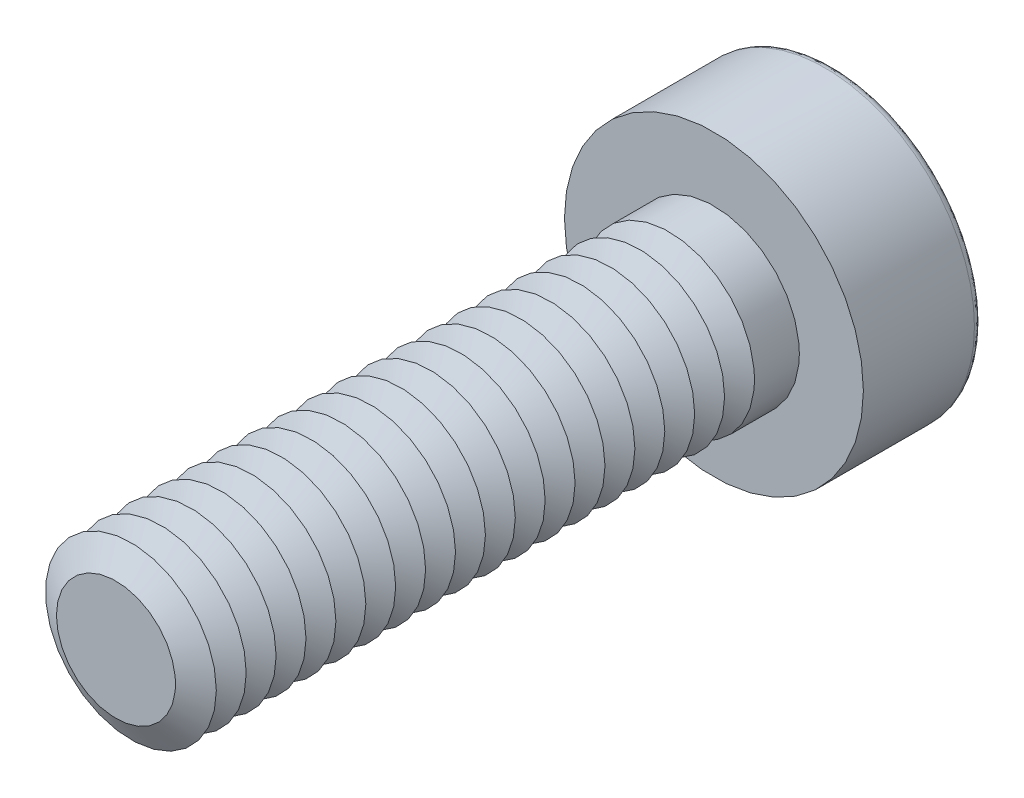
SolidWorks part; units mm, degrees
ref_plane "Front Plane" through (0, 0, 0) normal (0, 0, 1) x (1, 0, 0)
ref_plane "Top Plane" through (0, 0, 0) normal (0, 1, 0) x (1, 0, 0)
ref_plane "Right Plane" through (0, 0, 0) normal (1, 0, 0) x (0, 0, -1)
sketch "Sketch1" plane through (0, 0, 0) normal (0, 0, 1) x (1, 0, 0)
  circle A0 centre (0, 0) radius 2
  dimension "D1" = 4
extrude "Boss-Extrude1" add sketch "Sketch1" along normal blind 14
sketch "Sketch2" plane through (0, 0, 0) normal (0, 0, -1) x (-1, 0, 0)
  circle A0 centre (0, 0) radius 3.5
  dimension "D1" = 7
extrude "Boss-Extrude2" add sketch "Sketch2" along normal blind 2.8
sketch "Sketch3" plane through (0, 0, -2.8) normal (0, 0, -1) x (-1, 0, 0)
  line L1 (-0.7217, 1.25) -> (-1.4434, 0)
  line L2 (-1.4434, 0) -> (-0.7217, -1.25)
  line L3 (-0.7217, -1.25) -> (0.7217, -1.25)
  line L4 (0.7217, -1.25) -> (1.4434, 0)
  line L5 (1.4434, 0) -> (0.7217, 1.25)
  line L6 (0.7217, 1.25) -> (-0.7217, 1.25)
  circle A0 centre (0, 0) radius 1.25 construction
  dimension "D1" = 2.5
extrude "Cut-Extrude1" cut sketch "Sketch3" against normal blind 1.875
fillet "Fillet1" radius 0.2 1 edges at (-3.5, 0, -2.8)
sketch "Sketch4" plane through (0, 0, -0.925) normal (0, 0, -1) x (-1, 0, 0)
  line L0 (0.7217, -1.25) -> (1.4434, 0) construction
  circle A0 centre (0, 0) radius 1.25
extrude "Cut-Extrude2" cut sketch "Sketch4" against normal through all draft 60
sketch "Sketch5" plane through (0, 0, -2.8) normal (0, 0, -1) x (-1, 0, 0)
  circle A0 centre (0, 0) radius 1.4434
extrude "Cut-Extrude3" cut sketch "Sketch5" against normal through all draft 75
sketch "Sketch7" plane through (0, 0, 0) normal (1, 0, 0) x (0, 0, -1)
  line L25 (-14, 1.3938) -> (-13.65, 2)
  line L26 (-14, 2) -> (-14, -2) construction
  line L27 (-13.65, 2) -> (-14.35, 2)
  line L28 (-14.35, 2) -> (-14, 1.3938)
  line L29 (0, 2) -> (-14, 2) construction
  dimension "D1" = 0.7
revolve "Cut-Revolve1" cut sketch "Sketch7" angle 360 about axis through (0, 0, 14) along (0, 0, -1)
pattern_linear "LPattern1" count 19 spacing 0.7 along (0, 0, -1) of "Cut-Revolve1"
